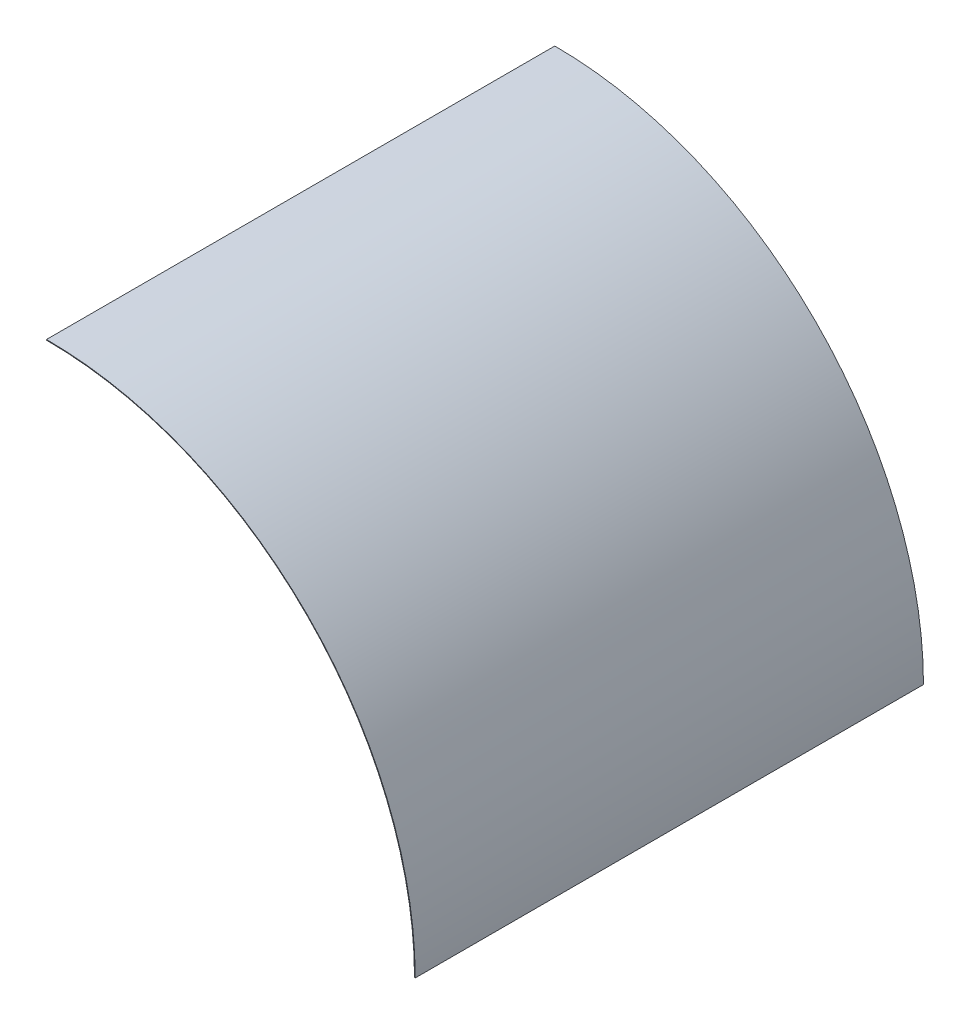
SolidWorks part; units mm, degrees
ref_plane "Front Plane" through (0, 0, 0) normal (0, 0, 1) x (1, 0, 0)
ref_plane "Top Plane" through (0, 0, 0) normal (0, 1, 0) x (1, 0, 0)
ref_plane "Right Plane" through (0, 0, 0) normal (1, 0, 0) x (0, 0, -1)
sketch "Sketch1" plane through (0, 0, 0) normal (0, 0, 1) x (1, 0, 0)
  line L0 (0, 0) -> (0, 45.174) construction
  line L1 (0, 0) -> (40.8023, 0) construction
  line L2 (0, 2176) -> (0, 2172)
  line L3 (2176, 0) -> (2172, 0)
  arc A0 (0, 2172) -> (2172, 0) centre (0, 0) cw
  arc A1 (0, 2176) -> (2176, 0) centre (0, 0) cw
  dimension "D1" = 2172
  dimension "D2" = 4
extrude "Boss-Extrude1" add sketch "Sketch1" against normal blind 3000
